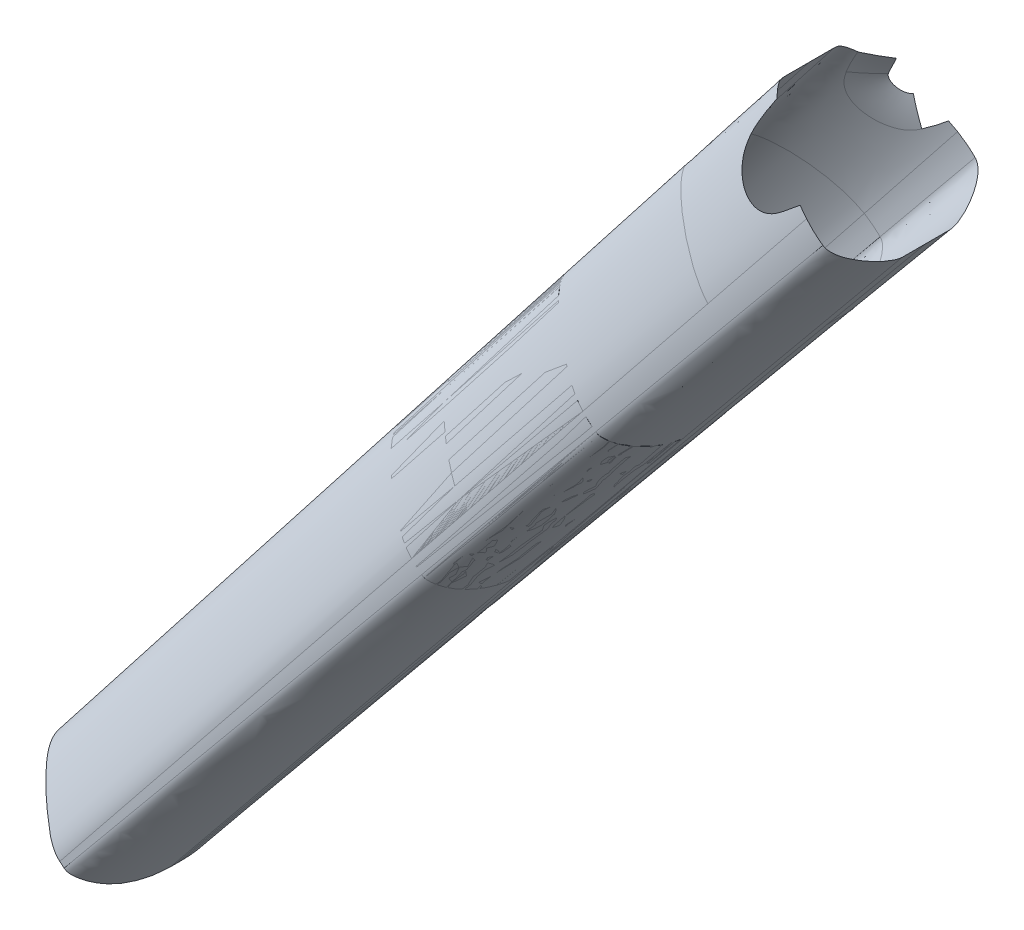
SolidWorks part; units mm, degrees
other "NONE"
ref_plane "Vorderansicht-XY" through (0, 0, 0) normal (0, 0, 1) x (1, 0, 0)
ref_plane "Draufsicht-ZX" through (0, 0, 0) normal (0, 1, 0) x (1, 0, 0)
ref_plane "Seitenansicht-YZ" through (0, 0, 0) normal (1, 0, 0) x (0, 0, -1)
imported_body "Oberfläche-Importiert1"
sketch "Skizze1" plane through (-22.569, 18.6939, 0) normal (-0.7701, 0.6379, 0) x (0, 0, 1)
  line L1 (66.5664, 193.4405) -> (-66.5663, 193.4405)
  line L2 (66.5664, 193.4405) -> (66.5664, 97.7427)
  line L3 (66.5664, 97.7427) -> (-66.5663, 97.7427)
  line L4 (-66.5663, 193.4405) -> (-66.5663, 97.7427)
  line L5 (66.5664, 193.4405) -> (-66.5663, 97.7427) construction
  line L6 (66.5664, 97.7427) -> (-66.5663, 193.4405) construction
  spline S0 degree 3 poles (0, 263.2295) (0, 142.539) (0, 21.8487) (0, -98.8383) (0, -98.8383) (0, -98.8383) (0, -98.8383) knots 16.558082 16.558082 16.558082 16.558082 82.392921 82.392921 82.392921 82.392923 82.392923 82.392923 82.392923 construction
  point P0 (0, 145.5916)
extrude "Aufsatz-Linear austragen1" add sketch "Skizze1" along normal mid plane 120
other "Schneiden1"
